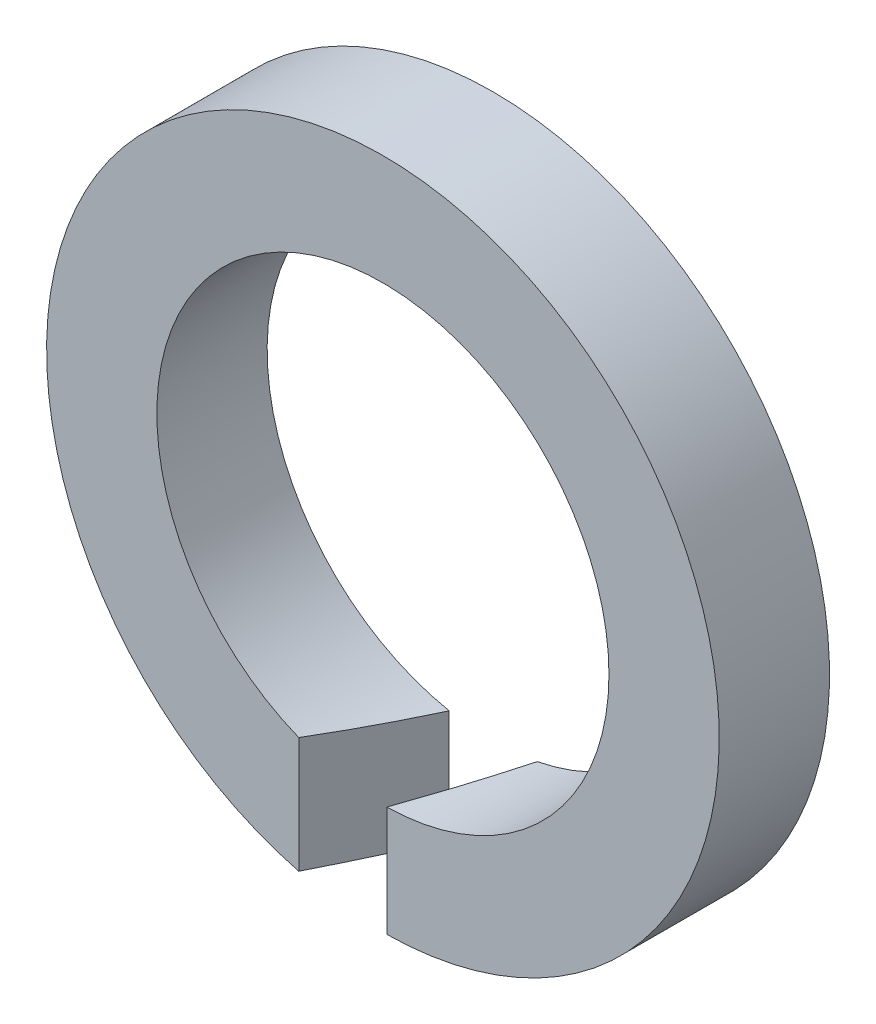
SolidWorks part; units mm, degrees
extrude "Основание-Вытянуть" add sketch "Эскиз1" along normal blind 2
sketch "Эскиз1" plane through (0, 0, 0) normal (0, 0, 1) x (1, 0, 0)
  circle A0 centre (0, 0) radius 4.1
  circle A1 centre (0, 0) radius 6.1
  dimension "D1" = 8.2
  dimension "D2" = 12.2
ref_plane "Plane1" through (0, 0, 0) normal (0, 0, 1) x (1, 0, 0)
ref_plane "Plane2" through (0, 0, 0) normal (0, 1, 0) x (1, 0, 0)
ref_plane "Plane3" through (0, 0, 0) normal (1, 0, 0) x (0, 0, -1)
sketch "Эскиз2" plane through (0, 0, 0) normal (0, 1, 0) x (1, 0, 0)
  line L0 (6.1, 0) -> (-6.1, 0) construction
  line L1 (0.7981, 0) -> (-0.7981, 0)
  line L2 (-4.1, -2) -> (4.1, -2) construction
  line L3 (-1.5261, -2) -> (0.0702, -2)
  line L4 (0.7981, 0) -> (0.0702, -2)
  line L5 (-0.7981, 0) -> (-1.5261, -2)
extrude "Вырез-Вытянуть1" cut sketch "Эскиз2" against normal through all
equation "\"D2@Эскиз2\" = \"D1@Основание-Вытянуть\"*.75"
equation "\"D3@Эскиз2\" = \"D2@Эскиз2\"*0.5"
